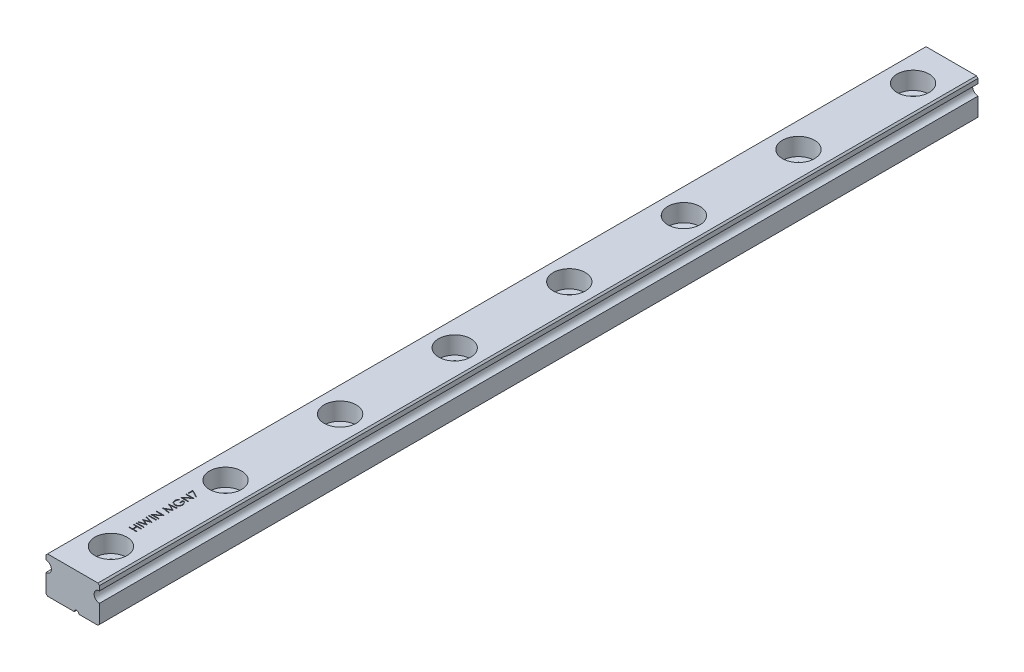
SolidWorks part; units mm, degrees
ref_plane "前视基准面" through (0, 0, 0) normal (0, 0, 1) x (1, 0, 0)
ref_plane "上视基准面" through (0, 0, 0) normal (0, 1, 0) x (1, 0, 0)
ref_plane "右视基准面" through (0, 0, 0) normal (1, 0, 0) x (0, 0, -1)
sketch "草图1" plane through (0, 0, 0) normal (0, 0, 1) x (1, 0, 0)
  line L2 (-3.5, 4.6) -> (-3.5, 4)
  line L3 (0.8, 0) -> (3.3, 0)
  line L4 (-3.3, 0) -> (0.2, 0)
  line L5 (-3.5, 0.2) -> (-3.3, 0)
  line L6 (3.5, 0.2) -> (3.5, 2.6)
  line L7 (-3.3, 4.8) -> (-3.5, 4.6)
  line L8 (-3.5, 2.6) -> (-3.5, 0.2)
  line L9 (3.5, 4) -> (3.5, 4.6)
  line L10 (3.3, 0) -> (3.5, 0.2)
  line L11 (3.5, 4.6) -> (3.3, 4.8)
  line L12 (3.3, 4.8) -> (-3.3, 4.8)
  line L13 (0, 4.8) -> (0, 0) construction
  arc A0 (3.5, 4) -> (3.5, 2.6) centre (3.5, 3.3) ccw
  arc A1 (-3.5, 2.6) -> (-3.5, 4) centre (-3.5, 3.3) ccw
  arc A2 (0.8, 0) -> (0.2, 0) centre (0.5, 0) ccw
extrude "凸台-拉伸1" add sketch "草图1" against normal blind 115
hole_wizard "M2 六角凹头螺钉的柱形沉头孔1" positions "草图3" profile "草图2" counterbore size "M2" standard "ISO"
sketch "草图3" plane through (1.648, 4.8, 19.9771) normal (0, 1, 0) x (-1, 0, 0)
  point P0 (1.648, -24.9771)
  dimension "D1" = 5
sketch "草图2" plane through (0, 4.8, -5) normal (1, 0, 0) x (0, 0, 1)
  line L0 (0, 0) -> (0, 4.8)
  line L1 (0, 4.8) -> (1.2, 4.8)
  line L3 (1.2, 4.8) -> (1.2, 2.3)
  line L4 (1.2, 2.3) -> (2.1, 2.3)
  line L5 (2.1, 2.3) -> (2.1, 0)
  line L7 (2.1, 0) -> (0, 0)
  line L11 (0, -6.35) -> (0, 107.95) construction
  dimension "通孔孔直径" = 2.4
  dimension "通孔孔深度" = 4.8
  dimension "柱形沉头孔直径" = 4.2
  dimension "柱形沉头孔深度" = 2.3
pattern_linear "阵列(线性)1" count 8 spacing 15 along (0, 0, -1) of "M2 六角凹头螺钉的柱形沉头孔1"
sketch "草图6" plane through (0, 4.8, 0) normal (0, 1, 0) x (1, 0, 0)
  line L0 (0, 5) -> (0, 20) construction
  text T0 "HIWIN MGN7" font "Century Gothic" height 1
extrude "切除-拉伸1" cut sketch "草图6" against normal blind 0.1
equation "\"D1@凸台-拉伸1\" = 2 * \"D1@草图3\" + \"D3@阵列(线性)1\" *  ( \"D1@阵列(线性)1\"  - 1) "
